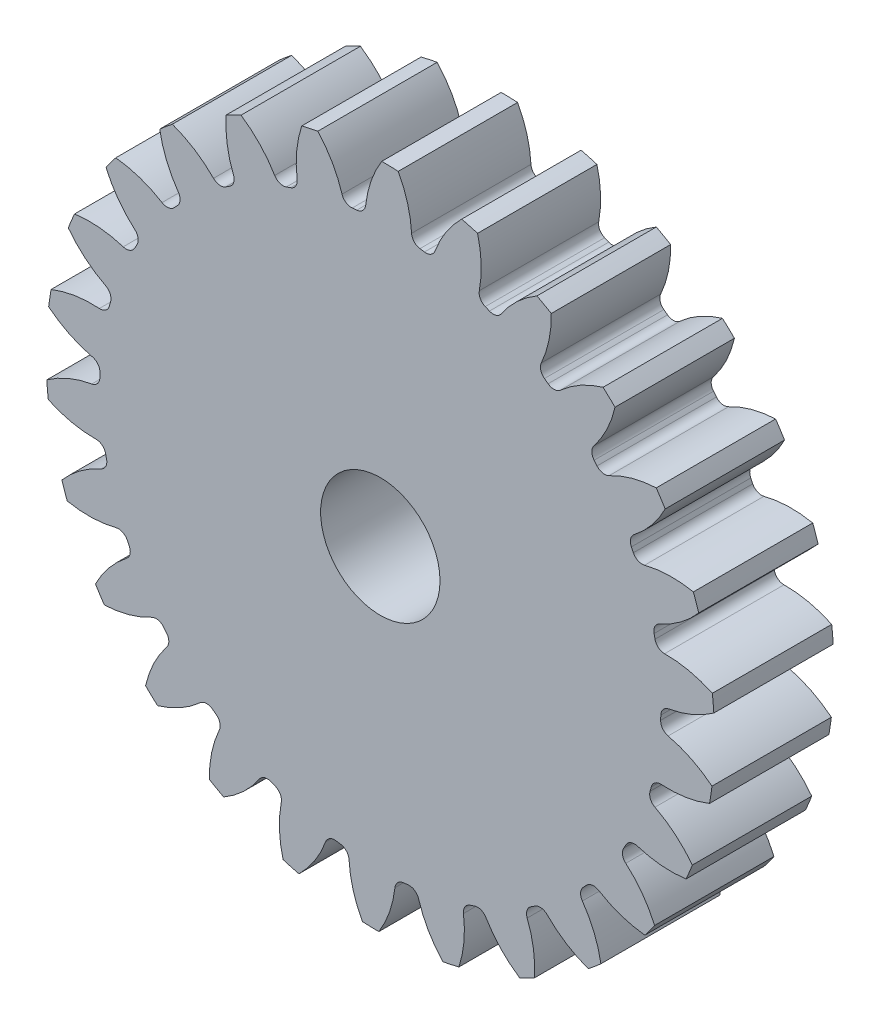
SolidWorks part; units mm, degrees
ref_plane "Front" through (0, 0, 0) normal (0, 0, 1) x (1, 0, 0)
ref_plane "Top" through (0, 0, 0) normal (0, 1, 0) x (1, 0, 0)
ref_plane "Right" through (0, 0, 0) normal (1, 0, 0) x (0, 0, -1)
sketch "Sketch3" plane through (0, 0, 0) normal (0, 0, 1) x (1, 0, 0)
  circle A0 centre (0, 0) radius 284.48
  dimension "od" = 568.96
extrude "gearBody" add sketch "Sketch3" along normal blind 101.6
sketch "Sketch2" plane through (0, 0, 0) normal (0, 0, 1) x (1, 0, 0)
  line L0 (0, 0) -> (229.3339, 94.9932) construction
  line L1 (282.8709, -36.0156) -> (0, 0) construction
  line L2 (0, 0) -> (36.3143, 0) construction
  line L3 (264.0306, 8.268) -> (263.1109, -23.5195) construction
  line L5 (263.5707, -7.6257) -> (0, 0) construction
  line L7 (0, 0) -> (248.2292, 0) construction
  arc A0 (248.2044, 3.5108) -> (247.5862, -17.8553) centre (0, 0) ccw construction
  arc A1 (283.8358, 19.1337) -> (282.2548, -35.5121) centre (0, 0) ccw construction
  arc A2 (264.0306, 8.268) -> (263.1109, -23.5195) centre (0, 0) ccw construction
  arc A3 (238.5963, -8.8387) -> (238.7082, -4.9709) centre (0, 0) ccw
  arc A4 (282.8709, -36.0156) -> (244.9574, -17.1931) centre (223.4581, -108.0936) ccw
  arc A5 (282.8709, -36.0156) -> (284.48, 19.6007) centre (0, 0) ccw
  arc A6 (284.48, 19.6007) -> (245.5417, 3.0017) centre (229.3339, 94.9932) cw
  arc A7 (238.7082, -4.9709) -> (245.5417, 3.0017) centre (246.9767, -5.1431) cw
  arc A8 (244.9574, -17.1931) -> (238.5963, -8.8387) centre (246.8609, -9.1449) cw
  point P6 (284.48, 19.6007)
  point P22 (282.8709, -36.0156)
  dimension "baseDia" = 496.4584
  dimension "od" = 568.96
  dimension "pd" = 528.32
  dimension "rd" = 477.52
  dimension "rFillet" = 8.2702
  dimension "pointX" = 284.48
  dimension "pointY" = 19.6007
  dimension "CTT" = 31.7875
  dimension "flankCenterAngle" = 22.5
extrude "toothCut" cut sketch "Sketch2" along normal through all
pattern_circular "CirPattern1" count 26 over 360 about axis through (0, 0, 0) along (0, 0, 1) of "toothCut"
sketch "hub1Dia" plane through (0, 0, 0) normal (0, 0, -1) x (-1, 0, 0)
  circle A0 centre (0, 0) radius 12.7
  dimension "hub1Dia" = 25.4
sketch "hub2Dia" plane through (0, 0, 101.6) normal (0, 0, 1) x (1, 0, 0)
  circle A0 centre (0, 0) radius 12.7
  dimension "hub2dia" = 25.4
sketch "boreDia" plane through (0, 0, 0) normal (0, 0, 1) x (1, 0, 0)
  circle A0 centre (0, 0) radius 50.8
  dimension "boreDia" = 101.6
extrude "bore" cut sketch "boreDia" against normal mid plane 25400
